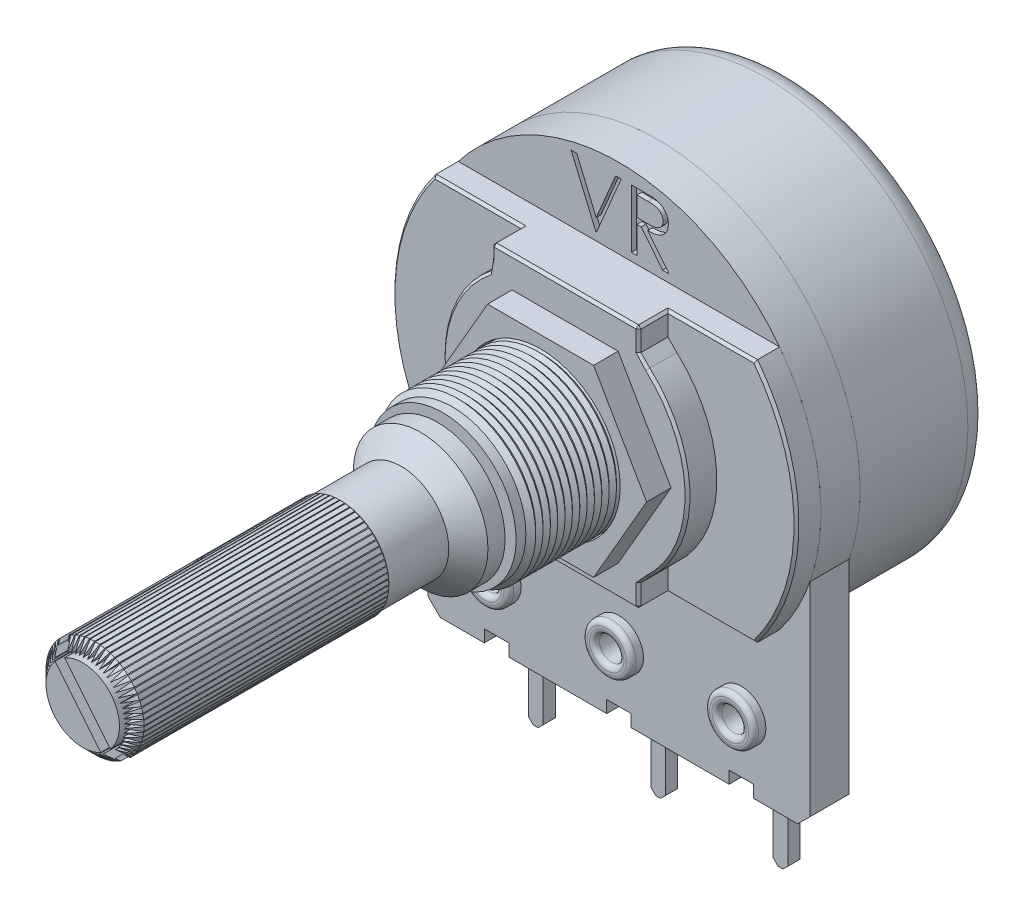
SolidWorks part; units mm, degrees
ref_plane "Front Plane" through (0, 0, 0) normal (0, 0, 1) x (1, 0, 0)
ref_plane "Top Plane" through (0, 0, 0) normal (0, 1, 0) x (1, 0, 0)
ref_plane "Right Plane" through (0, 0, 0) normal (1, 0, 0) x (0, 0, -1)
sketch "Sketch1" plane through (0, 0, 0) normal (0, 0, 1) x (1, 0, 0)
  circle A0 centre (0, 0) radius 8.25
  dimension "D1" = 16.5
extrude "Boss-Extrude1" add sketch "Sketch1" along normal blind 5.4
fillet "Fillet1" radius 1 1 edges at (8.25, 0, 0)
shell "Shell1" thickness 0.3
sketch "Sketch2" plane through (0, 0, 5.4) normal (0, 0, 1) x (1, 0, 0)
  line L2 (-7.8, -2.6875) -> (-7.8, -11.5)
  line L3 (-7.8, -11.5) -> (7.8, -11.5)
  line L4 (7.8, -2.6875) -> (7.8, -11.5)
  arc A0 (7.8, -2.6875) -> (-7.8, -2.6875) centre (0, 0) ccw
  dimension "D1" = 11.5
  dimension "D2" = 7.8
  dimension "D3" = 7.8
extrude "Boss-Extrude2" add sketch "Sketch2" along normal blind 1.6 separate body
chamfer "Chamfer1" distance 0.5 angle 45 2 edges at (7.8, -11.5, 6.2) (-7.8, -11.5, 6.2)
sketch "Sketch3" plane through (0, 0, 7) normal (0, 0, 1) x (1, 0, 0)
  line L1 (-6.5622, 5) -> (6.5622, 5)
  line L3 (-6.5622, -5) -> (6.5622, -5)
  arc A0 (-6.5622, 5) -> (-6.5622, -5) centre (0, 0) ccw
  arc A1 (6.5622, -5) -> (6.5622, 5) centre (0, 0) ccw
  point P0 (0, 0)
extrude "Boss-Extrude3" add sketch "Sketch3" along normal blind 1 separate body
sketch "Sketch4" plane through (0, 0, 8) normal (0, 0, 1) x (1, 0, 0)
  line L0 (-6.5622, -5) -> (6.5622, -5) construction
  line L2 (-3, 5) -> (3, 5)
  line L3 (-3, 5) -> (-3, -5)
  line L4 (-3, -5) -> (3, -5)
  line L5 (3, 5) -> (3, -5)
  line L6 (-3, 5) -> (3, -5) construction
  line L7 (-3, -5) -> (3, 5) construction
  circle A0 centre (0, 0) radius 5
  dimension "D1" = 6
extrude "Boss-Extrude4" add sketch "Sketch4" along normal blind 1.2 contours L3 A0 | L5 A0 L3 | L5 A0
sketch "Sketch5" plane through (0, 0, 9.2) normal (0, 0, 1) x (1, 0, 0)
  circle A0 centre (0, 0) radius 3
  dimension "D1" = 6
extrude "Boss-Extrude5" add sketch "Sketch5" along normal blind 5
sketch "Sketch6" plane through (0, 0, 14.2) normal (0, 0, 1) x (1, 0, 0)
  circle A0 centre (0, 0) radius 2.3
  dimension "D1" = 4.6
extrude "Cut-Extrude1" cut sketch "Sketch6" against normal blind 6
sketch "Sketch7" plane through (0, 0, 8.2) normal (0, 0, 1) x (1, 0, 0)
  circle A0 centre (0, 0) radius 2.25
  dimension "D1" = 4.5
extrude "Boss-Extrude6" add sketch "Sketch7" along normal blind 6.2
sketch "Sketch8" plane through (0, 0, 14.4) normal (0, 0, 1) x (1, 0, 0)
  circle A0 centre (0, 0) radius 2.75
  dimension "D1" = 5.5
extrude "Boss-Extrude7" add sketch "Sketch8" along normal blind 1.5
chamfer "Chamfer2" distance 0.8 angle 45 1 edges at (2.75, 0, 15.9)
sketch "Sketch9" plane through (0, 0, 15.9) normal (0, 0, 1) x (1, 0, 0)
  circle A0 centre (0, 0) radius 1.95
extrude "Boss-Extrude8" add sketch "Sketch9" along normal blind 2
sketch "Sketch10" plane through (0, 0, 17.9) normal (0, 0, 1) x (1, 0, 0)
  circle A0 centre (0, 0) radius 2
  dimension "D1" = 4
extrude "Boss-Extrude9" add sketch "Sketch10" along normal blind 11
chamfer "Chamfer3" distance 0.5 angle 45 2 edges at (2, 0, 28.9) (2, 0, 17.9)
sketch "Sketch11" plane through (0, 0, 7) normal (0, 0, 1) x (1, 0, 0)
  text T0 "VR" font "Century Gothic" height in points 9
sketch "Sketch12" plane through (0, 0, 28.9) normal (0, 0, 1) x (1, 0, 0)
  line L0 (0, 2.3) -> (0, -3) construction
  line L1 (-0.1, 1.4967) -> (0, 2.1)
  line L2 (0, 2.1) -> (0.1, 1.4967)
  circle A1 centre (0, 0) radius 3 construction
  arc A2 (0.1, 1.4967) -> (-0.1, 1.4967) centre (0, 0) ccw
  circle A3 centre (0, 0) radius 1.5 construction
  circle A4 centre (0, 0) radius 1.5
  dimension "D1" = 0.1
  dimension "D2" = 0.1
  dimension "D3" = 0.2
  dimension "D4" = 5.3
extrude "Cut-Extrude3" cut sketch "Sketch12" against normal up to surface (11 mm away) contours L2 L0 M1 | L0 L1 A4
pattern_circular "CirPattern1" count 60 over 360 about axis through (0, 0, 0) along (0, 0, 1) of "Cut-Extrude3"
sketch "Sketch13" plane through (0, 0, 7) normal (0, 0, 1) x (1, 0, 0)
  line L0 (-7.8, -8.782) -> (7.8, -8.782) construction
  line L1 (-7.8, -2.6875) -> (-7.8, -11) construction
  line L2 (7.8, -2.6875) -> (7.8, -11) construction
sketch "Sketch14" plane through (0, 0, 7) normal (0, 0, 1) x (1, 0, 0)
  line L0 (-7.8, -8.782) -> (7.8, -8.782) construction
  circle A0 centre (-5, -8.782) radius 1
  circle A1 centre (0, -8.782) radius 1
  circle A2 centre (5, -8.782) radius 1
  dimension "D1" = 2
  dimension "D2" = 5
  dimension "D3" = 5
extrude "Boss-Extrude10" add sketch "Sketch14" along normal blind 0.5
sketch "Sketch15" plane through (0, 0, 7.5) normal (0, 0, 1) x (1, 0, 0)
  circle A0 centre (-5, -8.782) radius 0.5
  circle A1 centre (0, -8.782) radius 0.5
  circle A2 centre (5, -8.782) radius 0.5
  dimension "D1" = 1
extrude "Cut-Extrude5" cut sketch "Sketch15" against normal through all
fillet "Fillet3" radius 0.2 6 edges at (5.5, -8.782, 7.5) (6, -8.782, 7.5) (0.5, -8.782, 7.5) (1, -8.782, 7.5) (-4.5, -8.782, 7.5) (-4, -8.782, 7.5)
sketch "Sketch16" plane through (0, 0, 7) normal (0, 0, 1) x (1, 0, 0)
  line L0 (-5, -8.782) -> (-5, -11.5) construction
  line L1 (-7.3, -11.5) -> (7.3, -11.5) construction
  line L2 (0, -8.782) -> (0, -11.5) construction
  line L3 (-7.8, -8.782) -> (7.8, -8.782) construction
  line L4 (5, -8.782) -> (5, -11.5) construction
  line L6 (-5.5, -11) -> (-4.5, -11)
  line L7 (-5.5, -11) -> (-5.5, -12)
  line L8 (-5.5, -12) -> (-4.5, -12)
  line L9 (-4.5, -11) -> (-4.5, -12)
  line L10 (-5.5, -11) -> (-4.5, -12) construction
  line L11 (-5.5, -12) -> (-4.5, -11) construction
  line L12 (-0.5, -11) -> (0.5, -11)
  line L13 (-0.5, -11) -> (-0.5, -12)
  line L14 (-0.5, -12) -> (0.5, -12)
  line L15 (0.5, -11) -> (0.5, -12)
  line L16 (-0.5, -11) -> (0.5, -12) construction
  line L17 (-0.5, -12) -> (0.5, -11) construction
  line L18 (4.5, -11) -> (5.5, -11)
  line L19 (4.5, -11) -> (4.5, -12)
  line L20 (4.5, -12) -> (5.5, -12)
  line L21 (5.5, -11) -> (5.5, -12)
  line L22 (4.5, -11) -> (5.5, -12) construction
  line L23 (4.5, -12) -> (5.5, -11) construction
  dimension "D1" = 1
  dimension "D2" = 0.5
extrude "Cut-Extrude6" cut sketch "Sketch16" against normal up to next
sketch "Sketch18" plane through (0, -11.5, 0) normal (0, -1, 0) x (1, 0, 0)
  line L1 (-6.4, 5.4) -> (6.4, 5.4)
  line L2 (-6.4, 5.4) -> (-6.4, 4.4)
  line L3 (-6.4, 4.4) -> (6.4, 4.4)
  line L4 (6.4, 5.4) -> (6.4, 4.4)
  line L6 (-7.3, 5.4) -> (-5.5, 5.4) construction
  line L7 (8.25, 5.4) -> (-8.25, 5.4) construction
  line L8 (5.5, 5.4) -> (7.3, 5.4) construction
  dimension "D1" = 1
extrude "Cut-Extrude7" cut sketch "Sketch18" against normal blind 10
sketch "Sketch21" plane through (0, 0, 0) normal (0, 1, 0) x (1, 0, 0)
  line L0 (3, -9.2) -> (3, -9.6)
  line L1 (3, -14.2) -> (3, -9.2) construction
  line L2 (3, -9.6) -> (3.2, -9.4)
  line L3 (3.2, -9.4) -> (3, -9.2)
  line L4 (3.2, -9.4) -> (-3, -9.4) construction
  line L5 (-3, -9.2) -> (-3, -14.2) construction
  line L6 (0, -15.9) -> (0, 0) construction
  line L7 (1.95, -15.9) -> (-1.95, -15.9) construction
  dimension "D1" = 0.2
  dimension "D2" = 0.2
  dimension "D3" = 0.2
revolve "Revolve1" add sketch "Sketch21" angle 360 about L6
pattern_linear "LPattern1" count 15 spacing 0.3 along (0, 0, 1) of "Revolve1"
sketch "Sketch22" plane through (0, 0, 9.2) normal (0, 0, 1) x (1, 0, 0)
  line L1 (-2.1651, -3.75) -> (2.1651, -3.75)
  line L2 (2.1651, -3.75) -> (4.3301, 0)
  line L3 (4.3301, 0) -> (2.1651, 3.75)
  line L4 (2.1651, 3.75) -> (-2.1651, 3.75)
  line L5 (-2.1651, 3.75) -> (-4.3301, 0)
  line L6 (-4.3301, 0) -> (-2.1651, -3.75)
  line L7 (3, -5) -> (6.5622, -5) construction
  circle A0 centre (0, 0) radius 3.75 construction
  circle A1 centre (0, 0) radius 3.25
  dimension "D2" = 6.5
  dimension "D1" = 7.5
extrude "Boss-Extrude14" add sketch "Sketch22" along normal blind 1
sketch "Sketch24" plane through (0, 0, 5.4) normal (0, 0, -1) x (-1, 0, 0)
  line L0 (7.8, -8.782) -> (-7.8, -8.782) construction
  line L1 (-5.75, -5.564) -> (-4.25, -5.564)
  line L2 (-5.75, -5.564) -> (-5.75, -12)
  line L3 (-5.75, -12) -> (-4.25, -12)
  line L4 (-4.25, -5.564) -> (-4.25, -12)
  line L5 (-5.75, -5.564) -> (-4.25, -12) construction
  line L6 (-5.75, -12) -> (-4.25, -5.564) construction
  line L7 (-0.75, -5.564) -> (0.75, -5.564)
  line L8 (-0.75, -5.564) -> (-0.75, -12)
  line L9 (-0.75, -12) -> (0.75, -12)
  line L10 (0.75, -5.564) -> (0.75, -12)
  line L11 (-0.75, -5.564) -> (0.75, -12) construction
  line L12 (-0.75, -12) -> (0.75, -5.564) construction
  line L13 (-5.5, -11.5) -> (-7.3, -11.5) construction
  line L14 (4.25, -5.564) -> (5.75, -5.564)
  line L15 (4.25, -5.564) -> (4.25, -12)
  line L16 (4.25, -12) -> (5.75, -12)
  line L17 (5.75, -5.564) -> (5.75, -12)
  line L18 (4.25, -5.564) -> (5.75, -12) construction
  line L19 (4.25, -12) -> (5.75, -5.564) construction
  point P0 (-5, -8.782)
  point P6 (0, -8.782)
  point P13 (5, -8.782)
  dimension "D1" = 1.5
  dimension "D2" = 0.5
extrude "Boss-Extrude18" add sketch "Sketch24" along normal blind 0.5 separate body
sketch "Sketch25" plane through (0, -12, 0) normal (0, -1, 0) x (1, 0, 0)
  line L0 (-5, 5.4) -> (-5, 4.9) construction
  line L1 (-4.25, 5.4) -> (-5.75, 5.4) construction
  line L2 (-4.25, 4.9) -> (-5.75, 4.9) construction
  line L3 (0, 4.9) -> (0, 5.4) construction
  line L4 (0, 15.9) -> (0, 0) construction
  line L5 (5, 5.4) -> (5, 4.9) construction
  line L6 (4.5, 5.4) -> (5.5, 5.4) construction
  line L7 (5.75, 4.9) -> (4.25, 4.9) construction
  line L8 (0.75, 4.9) -> (-0.75, 4.9) construction
  line L9 (-5.3, 5.4) -> (-4.7, 5.4)
  line L10 (-5.3, 5.4) -> (-5.3, 4.9)
  line L11 (-5.3, 4.9) -> (-4.7, 4.9)
  line L12 (-4.7, 5.4) -> (-4.7, 4.9)
  line L13 (-5.3, 5.4) -> (-4.7, 4.9) construction
  line L14 (-5.3, 4.9) -> (-4.7, 5.4) construction
  line L15 (-0.3, 5.4) -> (0.3, 5.4)
  line L16 (-0.3, 5.4) -> (-0.3, 4.9)
  line L17 (-0.3, 4.9) -> (0.3, 4.9)
  line L18 (0.3, 5.4) -> (0.3, 4.9)
  line L19 (-0.3, 5.4) -> (0.3, 4.9) construction
  line L20 (-0.3, 4.9) -> (0.3, 5.4) construction
  line L22 (4.7, 5.4) -> (5.3, 5.4)
  line L23 (4.7, 5.4) -> (4.7, 4.9)
  line L24 (4.7, 4.9) -> (5.3, 4.9)
  line L25 (5.3, 5.4) -> (5.3, 4.9)
  line L26 (4.7, 5.4) -> (5.3, 4.9) construction
  line L27 (4.7, 4.9) -> (5.3, 5.4) construction
  point P16 (-5, 5.15)
  point P21 (0, 5.15)
  point P28 (5, 5.15)
  dimension "D1" = 0.6
extrude "Boss-Extrude19" add sketch "Sketch25" along normal blind 3
chamfer "Chamfer4" distance 0.2 angle 45 4 edges at (4.7, -15, 5.15) (5.3, -15, 5.15) (4.25, -12, 5.15) (5.75, -12, 5.15)
chamfer "Chamfer5" distance 0.2 angle 45 4 edges at (-0.3, -15, 5.15) (0.3, -15, 5.15) (-0.75, -12, 5.15) (0.75, -12, 5.15)
chamfer "Chamfer6" distance 0.2 angle 45 1 edges at (-4.7, -15, 5.15)
sketch "Sketch26" plane through (0, 0, 5.4) normal (0, 0, 1) x (1, 0, 0)
  line L0 (-7.8, -8.782) -> (7.8, -8.782) construction
  circle A0 centre (-5, -8.782) radius 0.5
  circle A1 centre (0, -8.782) radius 0.5
  circle A2 centre (5, -8.782) radius 0.5
extrude "Cut-Extrude9" cut sketch "Sketch26" against normal up to surface (0.5 mm away)
chamfer "Chamfer7" distance 0.1 angle 45 26 edges at (8.25, 0, 8) (3, -4, 8.6) (3, 4, 8.6) (5, 0, 9.2) (-3, 4.5, 9.2) (-5, 0, 9.2) (-3, -4.5, 9.2) (0, -5, 9.2) (3, -4.5, 9.2) (-3, -4, 8.6) (-3, 4, 8.6) (0, 5, 9.2) (3, 4.5, 9.2) (-8.25, 0, 8)
extrude "Cut-Extrude10" cut sketch "Sketch11" against normal blind 0.2
sketch "Sketch28" plane through (0, 0, 28.9) normal (0, 0, 1) x (1, 0, 0)
  line L0 (-1.2586, 1.5543) -> (1.2586, -1.5543) construction
  line L1 (-2.332, 2.4825) -> (2.1436, -3.0444)
  line L2 (2.1436, -3.0444) -> (2.5322, -2.7297)
  line L3 (2.5322, -2.7297) -> (-1.9434, 2.7972)
  line L4 (-1.9434, 2.7972) -> (-2.332, 2.4825)
  arc A0 (-1.1889, 1.6082) -> (-1.3259, 1.4973) centre (0, 0) ccw construction
  arc A1 (1.1889, -1.6082) -> (1.3259, -1.4973) centre (0, 0) ccw construction
  dimension "D1" = 0.5
  dimension "D2" = 0.5
extrude "Cut-Extrude11" cut sketch "Sketch28" against normal blind 6
